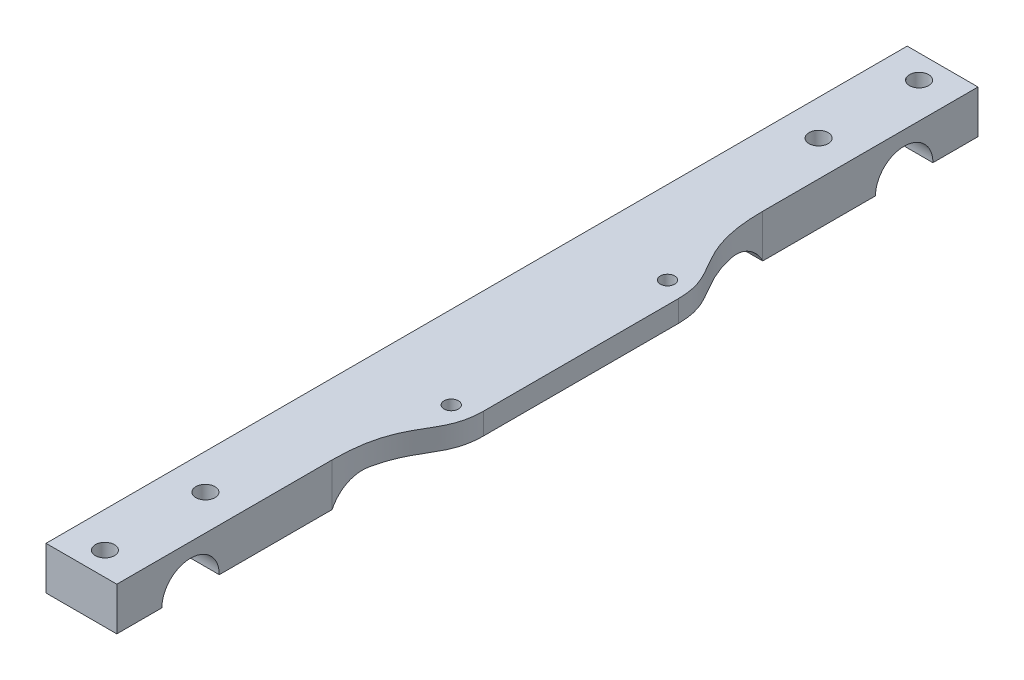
SolidWorks part; units mm, degrees
ref_plane "Front Plane" through (0, 0, 0) normal (0, 0, 1) x (1, 0, 0)
ref_plane "Top Plane" through (0, 0, 0) normal (0, 1, 0) x (1, 0, 0)
ref_plane "Right Plane" through (0, 0, 0) normal (1, 0, 0) x (0, 0, -1)
sketch "Sketch2" plane through (0, 0, 0) normal (1, 0, 0) x (0, 0, -1)
  line L1 (-90, -4.5) -> (90, -4.5)
  line L2 (-90, -4.5) -> (-90, 4.5)
  line L3 (-90, 4.5) -> (90, 4.5)
  line L4 (90, -4.5) -> (90, 4.5)
  line L5 (-90, -4.5) -> (90, 4.5) construction
  line L6 (-90, 4.5) -> (90, -4.5) construction
  point P0 (0, 0)
  dimension "D1" = 9
  dimension "D2" = 180
extrude "Boss-Extrude1" add sketch "Sketch2" along normal blind 14.8
sketch "Sketch3" plane through (14.8, 0, 0) normal (1, 0, 0) x (0, 0, -1)
  line L0 (-90, -4.5) -> (90, -4.5) construction
  line L1 (-74.579, -4.5) -> (74.579, -4.5) construction
  line L7 (90, -4.5) -> (90, 4.5)
  line L8 (90, 4.5) -> (-90, 4.5)
  line L9 (-90, 4.5) -> (-90, -4.5)
  line L10 (-90, -4.5) -> (90, -4.5)
  line L11 (90, -4.5) -> (90, 4.5)
  line L12 (90, 4.5) -> (-90, 4.5)
  line L13 (-90, 4.5) -> (-90, -4.5)
  arc A0 (-68.579, -4.5) -> (-80.579, -4.5) centre (-74.579, -4.5) ccw
  arc A1 (80.579, -4.5) -> (68.579, -4.5) centre (74.579, -4.5) ccw
  point P10 (0, -4.5)
  dimension "D1" = 6
  dimension "D2" = 149.158
  dimension "D4" = 0
extrude "Bar Holes" cut sketch "Sketch3" against normal through all
sketch "Sketch6" plane through (0, 4.5, 0) normal (0, 1, 0) x (1, 0, 0)
  line L0 (7.4, 64.079) -> (7.4, -64.079) construction
  line L1 (14.8, 90) -> (0, 90) construction
  line L2 (14.8, -90) -> (0, -90) construction
  line L3 (0, -68.579) -> (14.8, -68.579) construction
  line L4 (0, -80.579) -> (14.8, -80.579) construction
  line L5 (-32.5661, 0) -> (77.6197, 0) construction
  circle A0 centre (7.4, 64.079) radius 2
  circle A1 centre (7.4, -64.079) radius 2
  circle A2 centre (7.4, -85.079) radius 2
  circle A3 centre (7.4, 85.079) radius 2
  circle A4 centre (7.4, -32.5) radius 3.5 construction
  circle A5 centre (7.4, 32.5) radius 3.5 construction
  circle A6 centre (17.2995, 22.6005) radius 1.5 construction
  circle A8 centre (17.2995, 22.6005) radius 5 construction
  point P4 (7.4, 0)
  point P8 (7.4, 90)
  point P17 (7.4, -90)
  dimension "D1" = 4
  dimension "D2" = 4
  dimension "D5" = 4
  dimension "D6" = 4
  dimension "D10" = 7
  dimension "D11" = 7
  dimension "D7" = 32.5
  dimension "D12" = 3
  dimension "D14" = 9.8995
  dimension "D3" = 4.5
  dimension "D4" = 4.5
  dimension "D8" = 4.5
  dimension "D9" = 32.5
  dimension "D13" = 14
extrude "Bolt Holes" cut sketch "Sketch6" against normal through all
sketch "Sketch7" plane through (14.8, 0, 0) normal (1, 0, 0) x (0, 0, -1)
  line L0 (-68.579, -4.5) -> (68.579, -4.5) construction
  line L1 (-45, -4.5) -> (45, -4.5)
  line L2 (-45, -4.5) -> (-45, 0)
  line L3 (-45, 0) -> (45, 0)
  line L4 (45, -4.5) -> (45, 0)
  point P6 (0, 0)
  dimension "D1" = 90
extrude "Cut-Extrude1" cut sketch "Sketch7" against normal through all
sketch "Sketch8" plane through (14.8, 0, 0) normal (1, 0, 0) x (0, 0, -1)
  line L1 (90, 4.5) -> (-90, 4.5) construction
  line L3 (45, 0) -> (45, 4.5)
  line L5 (-45, 0) -> (-45, 4.5)
  line L6 (-45, 4.5) -> (45, 4.5)
  line L7 (45, 0) -> (-45, 0)
extrude "Boss-Extrude2" add sketch "Sketch8" along normal blind 7
sketch "Sketch10" plane through (0, 0, 0) normal (0, -1, 0) x (1, 0, 0)
  line L0 (17.2995, -22.6005) -> (7.4, -32.5) construction
  line L1 (-13.7406, 0) -> (37.2021, 0) construction
  line L4 (14.8, -45) -> (14.8, -29.7858) construction
  line L5 (14.8, -29.7858) -> (21.8, -29.7858) construction
  line L6 (21.8, 45) -> (21.8, -45) construction
  line L7 (21.8, -29.7858) -> (21.8, -20.3664) construction
  line L8 (21.8, -20.3664) -> (30.1723, -20.3664)
  line L9 (30.1723, -20.3664) -> (30.1723, -52.0388)
  line L10 (30.1723, -52.0388) -> (14.8, -52.0388)
  line L11 (14.8, -45) -> (14.8, -68.579) construction
  line L12 (14.8, -52.0388) -> (14.8, -45)
  line L13 (30.1723, 52.0388) -> (14.8, 52.0388)
  line L14 (30.1723, 20.3664) -> (30.1723, 52.0388)
  line L15 (21.8, 20.3664) -> (30.1723, 20.3664)
  line L16 (14.8, 45) -> (14.8, 29.7858) construction
  line L17 (14.8, 29.7858) -> (21.8, 29.7858) construction
  line L18 (21.8, 29.7858) -> (21.8, 20.3664) construction
  line L19 (14.8, 52.0388) -> (14.8, 45)
  circle A0 centre (17.2995, -22.6005) radius 1.5
  circle A1 centre (7.4, -32.5) radius 3.5 construction
  circle A2 centre (17.2995, 22.6005) radius 1.5
  spline S0 degree 3 poles (14.8, -45) (14.8, -29.7858) (21.8, -29.7858) (21.8, -20.3664) knots 0 0 0 0 1 1 1 1
  spline S1 degree 3 poles (14.8, 45) (14.8, 29.7858) (21.8, 29.7858) (21.8, 20.3664) knots 0 0 0 0 1 1 1 1
  point P28 (21.8, -20.3664)
  dimension "D1" = 45
  dimension "D2" = 14
extrude "Cut-Extrude2" cut sketch "Sketch10" against normal blind 8
fillet "Fillet1" radius 8 2 edges at (7.4, 0, 45) (7.4, 0, -45)
